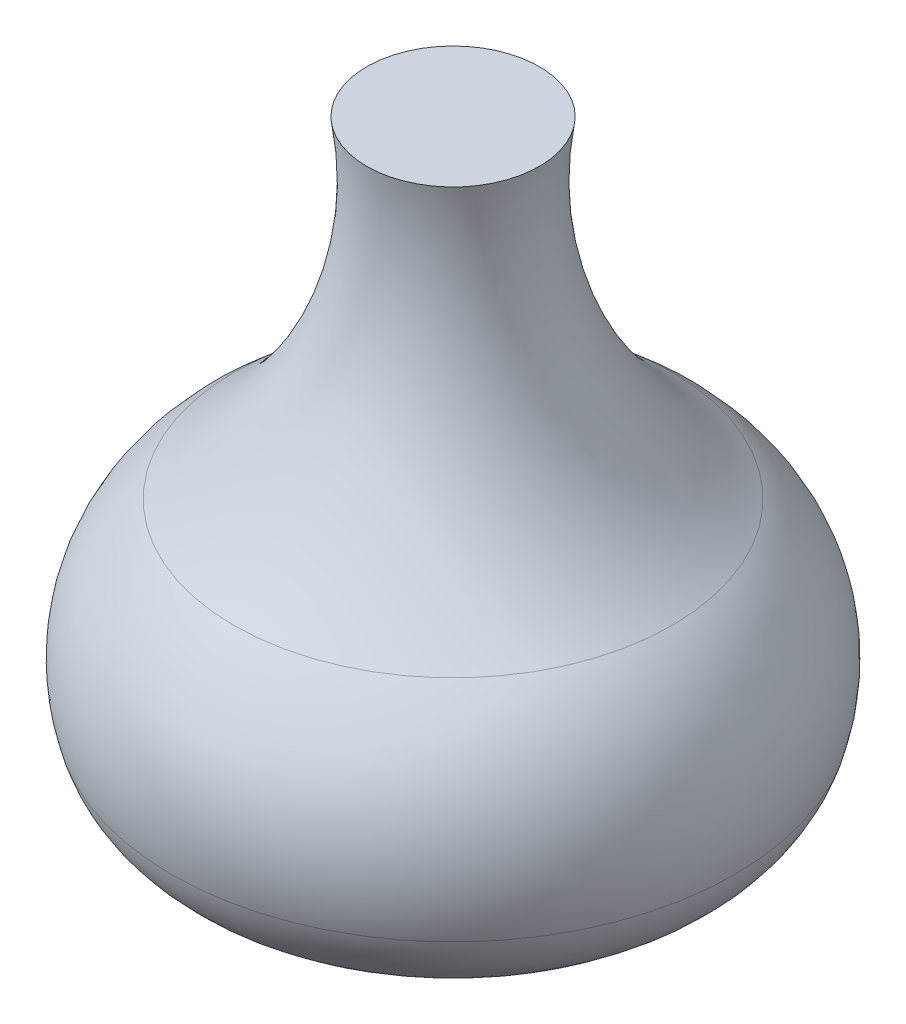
SolidWorks part; units mm, degrees
ref_plane "前视基准面" through (0, 0, 0) normal (0, 0, 1) x (1, 0, 0)
ref_plane "上视基准面" through (0, 0, 0) normal (0, 1, 0) x (1, 0, 0)
ref_plane "右视基准面" through (0, 0, 0) normal (1, 0, 0) x (0, 0, -1)
sketch "草图1" plane through (0, 0, 0) normal (0, 0, 1) x (1, 0, 0)
  line L0 (0, 76.9471) -> (0, -69.1029) construction
  line L1 (0, 53.0412) -> (-15, 53.0412)
  line L2 (-36.8605, -49.7915) -> (0, -49.7915)
  line L3 (0, 53.0412) -> (0, -49.7915)
  arc A0 (-15, 53.0412) -> (-17.8545, 22.8365) centre (-74.2204, 43.4006) cw
  arc A1 (-17.8545, 22.8365) -> (-38.0711, -4.487) centre (-74.2204, 43.4006) cw
  arc A2 (-38.0711, -4.487) -> (-48.8678, -36.5824) centre (-19.9965, -28.4309) ccw
  arc A3 (-48.8678, -36.5824) -> (-36.8605, -49.7915) centre (-29.6203, -31.148) ccw
  dimension "D2" = 60
  dimension "D3" = 60
  dimension "D4" = 30
  dimension "D5" = 20
  dimension "D1" = 15
revolve "旋转1" add sketch "草图1" angle 360 about L0
